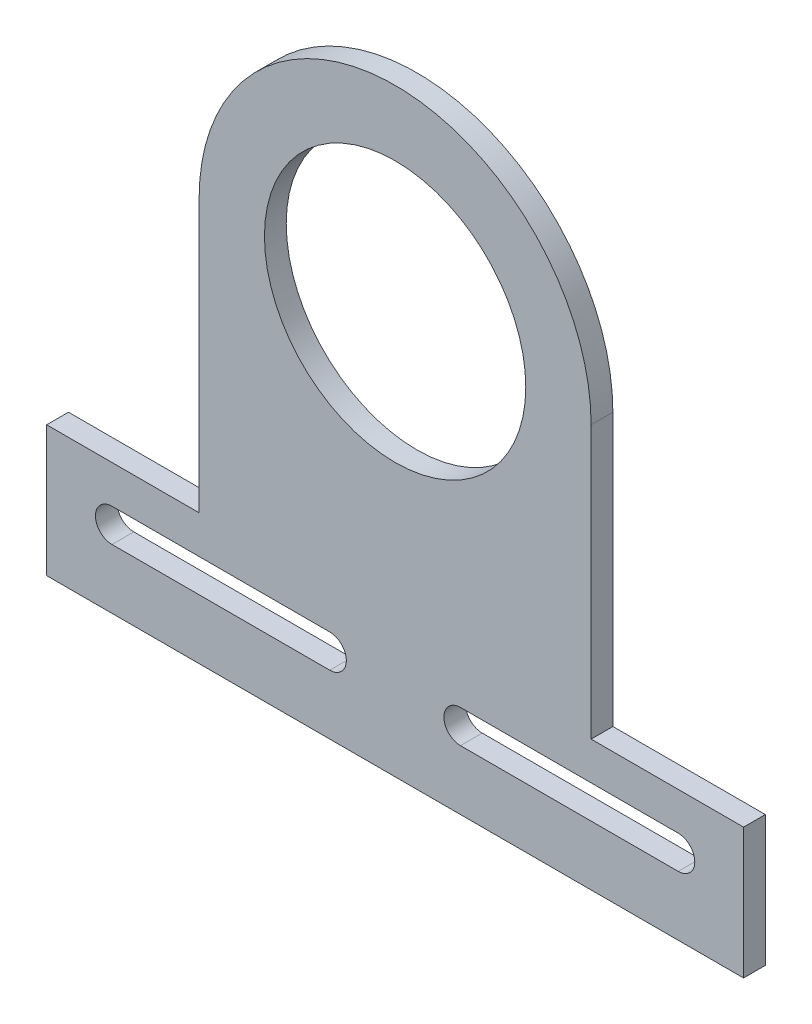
SolidWorks part; units mm, degrees
ref_plane "Front Plane" through (0, 0, 0) normal (0, 0, 1) x (1, 0, 0)
ref_plane "Top Plane" through (0, 0, 0) normal (0, 1, 0) x (1, 0, 0)
ref_plane "Right Plane" through (0, 0, 0) normal (1, 0, 0) x (0, 0, -1)
sketch "Sketch1" plane through (0, 0, 0) normal (0, 0, 1) x (1, 0, 0)
  line L1 (57.15, 0) -> (57.15, -79.375)
  line L2 (57.15, -79.375) -> (101.6, -79.375)
  line L3 (101.6, -79.375) -> (101.6, -117.475)
  line L4 (101.6, -117.475) -> (-101.6, -117.475)
  line L5 (-101.6, -117.475) -> (-101.6, -79.375)
  line L6 (-101.6, -79.375) -> (-57.15, -79.375)
  line L7 (-57.15, -79.375) -> (-57.15, 0)
  arc A0 (-57.15, 0) -> (57.15, 0) centre (0, 0) cw
  circle A1 centre (0, 0) radius 14.2875
  dimension "D1" = 57.15
  dimension "D6" = 28.575
  dimension "D2" = 203.2
  dimension "D3" = 117.475
  dimension "D4" = 101.6
  dimension "D5" = 38.1
extrude "Extrude1" add sketch "Sketch1" along normal blind 6.35
sketch "Sketch2" plane through (0, 0, 6.35) normal (0, 0, 1) x (1, 0, 0)
  circle A0 centre (0, 0) radius 38.1
  dimension "D1" = 76.2
extrude "Cut-Extrude1" cut sketch "Sketch2" against normal through all
sketch "Sketch4" plane through (0, 0, 6.35) normal (0, 0, 1) x (1, 0, 0)
  line L0 (-101.6, -117.475) -> (101.6, -117.475) construction
  line L1 (-82.55, -100.076) -> (-19.05, -100.076)
  line L2 (-19.05, -90.424) -> (-82.55, -90.424)
  line L3 (0, 63.4541) -> (0, -166.0452) construction
  arc A0 (-82.55, -90.424) -> (-82.55, -100.076) centre (-82.55, -95.25) ccw
  arc A1 (-19.05, -100.076) -> (-19.05, -90.424) centre (-19.05, -95.25) ccw
  dimension "D1" = 4.826
  dimension "D2" = 63.5
  dimension "D3" = 22.225
  dimension "D4" = 19.05
extrude "Cut-Extrude3" cut sketch "Sketch4" against normal through all
mirror "Mirror1" about plane through (0, 0, 0) normal (1, 0, 0) of "Cut-Extrude3"
